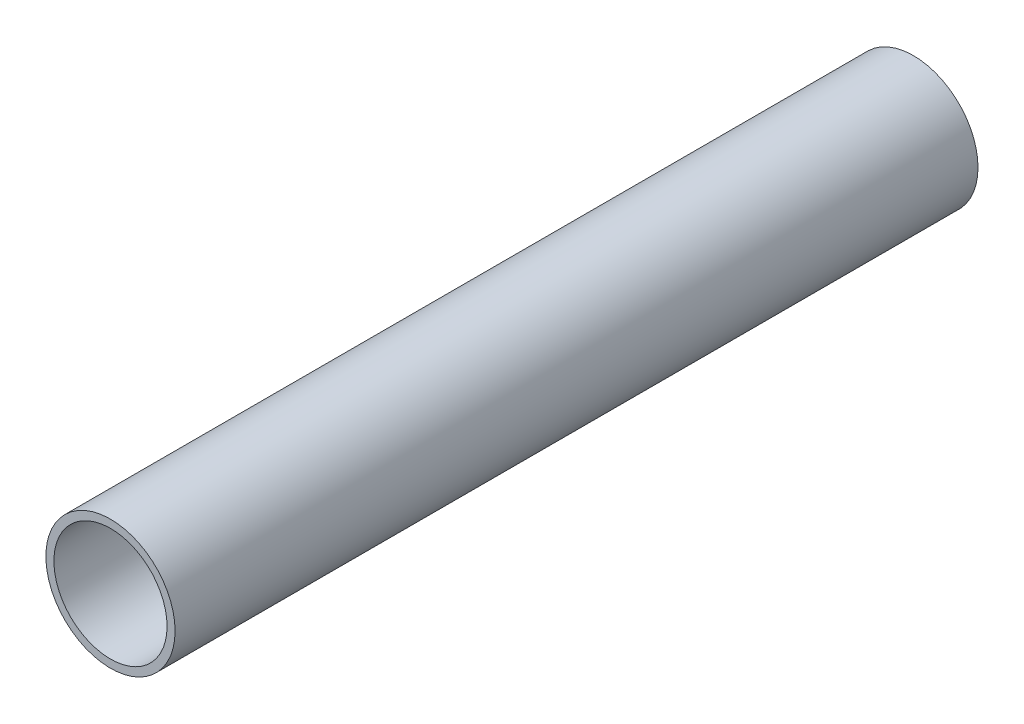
SolidWorks part; units mm, degrees
ref_plane "Front Plane" through (0, 0, 0) normal (0, 0, 1) x (1, 0, 0)
ref_plane "Top Plane" through (0, 0, 0) normal (0, 1, 0) x (1, 0, 0)
ref_plane "Right Plane" through (0, 0, 0) normal (1, 0, 0) x (0, 0, -1)
sketch "Sketch1" plane through (0, 0, 0) normal (0, 0, 1) x (1, 0, 0)
  circle A0 centre (0, 0) radius 44.45
  circle A1 centre (0, 0) radius 38.9382
  dimension "D1" = 88.9
  dimension "D2" = 77.8764
extrude "Extrude1" add sketch "Sketch1" along normal mid plane 552.45
